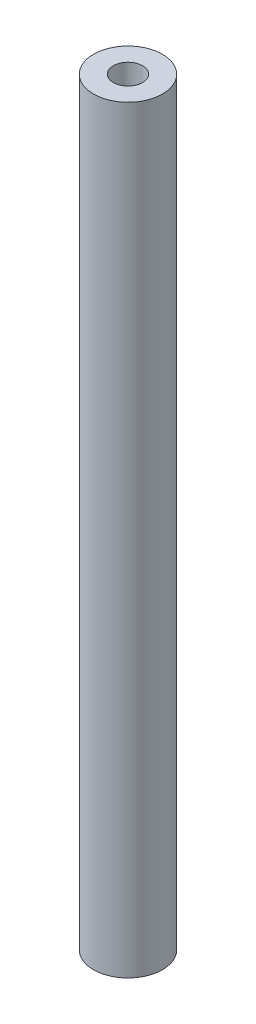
SolidWorks part; units mm, degrees
ref_plane "Front Plane" through (0, 0, 0) normal (0, 0, 1) x (1, 0, 0)
ref_plane "Top Plane" through (0, 0, 0) normal (0, 1, 0) x (1, 0, 0)
ref_plane "Right Plane" through (0, 0, 0) normal (1, 0, 0) x (0, 0, -1)
sketch "Sketch2" plane through (0, 0, 0) normal (0, 1, 0) x (1, 0, 0)
  circle A0 centre (0, 0) radius 4.7625
  circle A1 centre (0, 0) radius 2.0193
  dimension "D1" = 9.525
  dimension "D2" = 4.0386
extrude "Boss-Extrude1" add sketch "Sketch2" along normal blind 104.775
